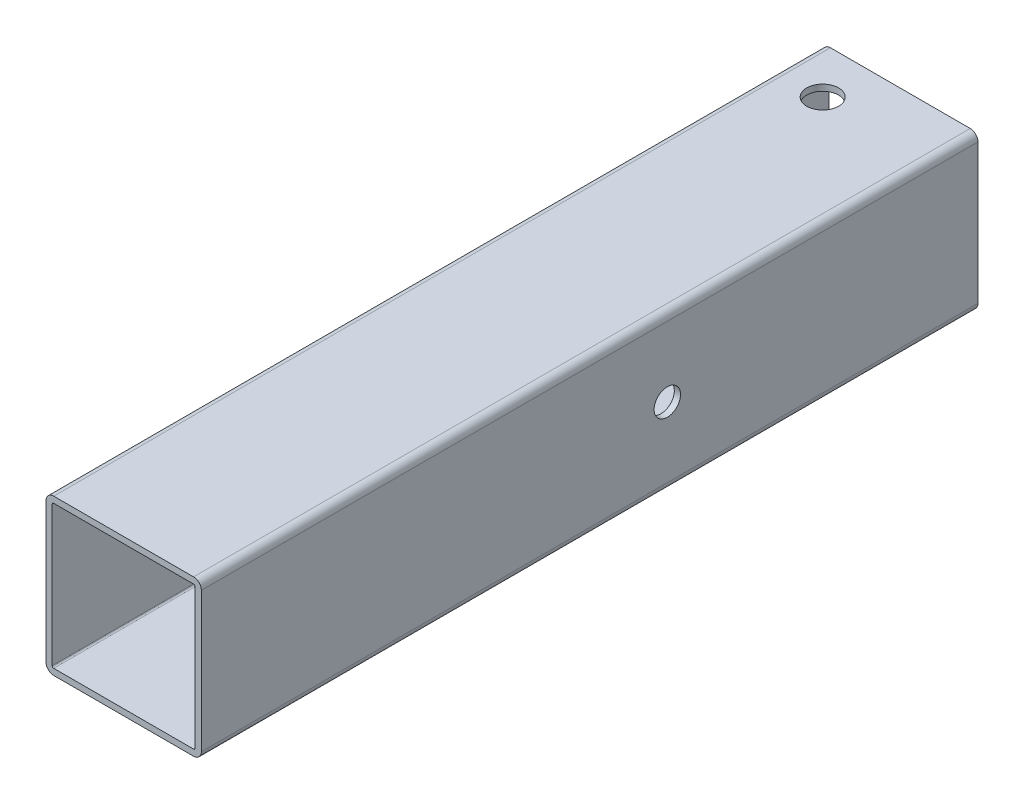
SolidWorks part; units mm, degrees
ref_plane "Face" through (0, 0, 0) normal (0, 0, 1) x (1, 0, 0)
ref_plane "Dessus" through (0, 0, 0) normal (0, 1, 0) x (1, 0, 0)
ref_plane "Droite" through (0, 0, 0) normal (1, 0, 0) x (0, 0, -1)
sketch "Esquisse1" plane through (0, 0, 0) normal (0, 0, 1) x (1, 0, 0)
  line L0 (5, -4) -> (95, -4)
  line L1 (5, 0) -> (95, 0)
  line L2 (0, -5) -> (0, -95)
  line L3 (5, -100) -> (95, -100)
  line L4 (100, -5) -> (100, -95)
  line L5 (96, -5) -> (96, -95)
  line L6 (5, -96) -> (95, -96)
  line L7 (4, -5) -> (4, -95)
  arc A0 (100, -5) -> (95, 0) centre (95, -5) ccw
  arc A1 (95, -100) -> (100, -95) centre (95, -95) ccw
  arc A2 (5, -100) -> (0, -95) centre (5, -95) cw
  arc A3 (5, 0) -> (0, -5) centre (5, -5) ccw
  arc A4 (96, -5) -> (95, -4) centre (95, -5) ccw
  arc A5 (95, -96) -> (96, -95) centre (95, -95) ccw
  arc A6 (5, -96) -> (4, -95) centre (5, -95) cw
  arc A7 (5, -4) -> (4, -5) centre (5, -5) ccw
  point P7 (100, 0)
  point P12 (0, -100)
  point P15 (0, 0)
  dimension "D3" = 5
  dimension "D1" = 100
  dimension "D2" = 100
  dimension "D4" = 4
extrude "Base-Extrusion" add sketch "Esquisse1" along normal blind 500
sketch "Esquisse2" plane through (0, 0, 0) normal (-1, 0, 0) x (0, 0, 1)
  line L0 (500, 0) -> (0, 0) construction
  line L1 (0, -5) -> (0, -95) construction
  circle A0 centre (200, -50) radius 8.5
  dimension "D2" = 17
  dimension "D1" = 50
  dimension "D3" = 200
extrude "Enlèv. mat.-Extru.1" cut sketch "Esquisse2" against normal through all
sketch "Esquisse3" plane through (0, 0, 0) normal (-1, 0, 0) x (0, 0, 1)
  line L0 (0, -5) -> (0, -95) construction
  line L1 (500, -100) -> (0, -100) construction
  circle A0 centre (30, -85) radius 3.25
  dimension "D3" = 6.5
  dimension "D1" = 30
  dimension "D2" = 15
extrude "Enlèv. mat.-Extru.2" cut sketch "Esquisse3" against normal blind 10
sketch "Esquisse4" plane through (0, 0, 0) normal (0, 1, 0) x (-1, 0, 0)
  line L0 (-95, 0) -> (-5, 0) construction
  line L1 (0, 500) -> (0, 0) construction
  circle A0 centre (-30, 30) radius 10.25
  dimension "D3" = 20.5
  dimension "D1" = 30
  dimension "D2" = 30
extrude "Enlèv. mat.-Extru.3" cut sketch "Esquisse4" against normal through all
